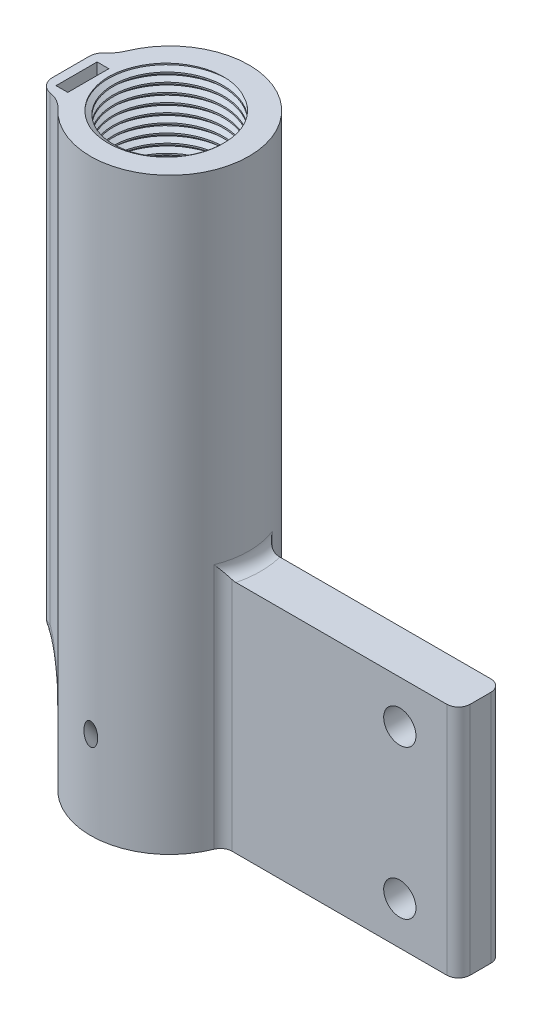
SolidWorks part; units mm, degrees
ref_plane "Front Plane" through (0, 0, 0) normal (0, 0, 1) x (1, 0, 0)
ref_plane "Top Plane" through (0, 0, 0) normal (0, 1, 0) x (1, 0, 0)
ref_plane "Right Plane" through (0, 0, 0) normal (1, 0, 0) x (0, 0, -1)
imported_body "Stock-Tube_2-1"
move or copy body "Body-Move/Copy1" bodies to move or copy 101 copy no rotation origin (0, -0.6742, 67.877) rotation axis (-1, 0, 0) rotation angle 90
